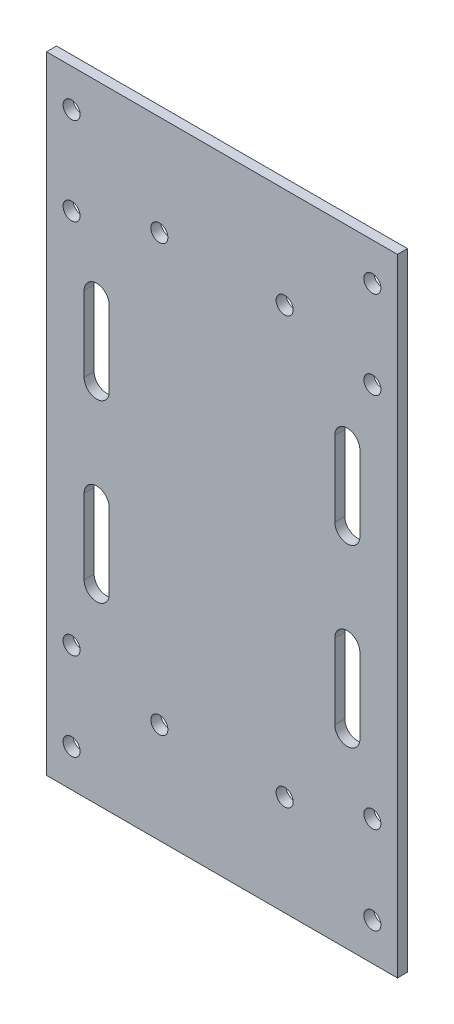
SolidWorks part; units mm, degrees
ref_plane "Front Plane" through (0, 0, 0) normal (0, 0, 1) x (1, 0, 0)
ref_plane "Top Plane" through (0, 0, 0) normal (0, 1, 0) x (1, 0, 0)
ref_plane "Right Plane" through (0, 0, 0) normal (1, 0, 0) x (0, 0, -1)
sketch "Sketch1" plane through (0, 0, 0) normal (0, 0, 1) x (1, 0, 0)
  line L1 (-35, -62.5) -> (35, -62.5)
  line L2 (-35, -62.5) -> (-35, 62.5)
  line L3 (-35, 62.5) -> (35, 62.5)
  line L4 (35, -62.5) -> (35, 62.5)
  line L5 (-35, -62.5) -> (35, 62.5) construction
  line L6 (-35, 62.5) -> (35, -62.5) construction
  point P0 (0, 0)
  dimension "D1" = 35
  dimension "D2" = 62.5
extrude "Boss-Extrude1" add sketch "Sketch1" against normal blind 2
sketch "Sketch2" plane through (0, 0, 0) normal (0, 0, 1) x (1, 0, 0)
  circle A0 centre (-30, -55) radius 1.7
  circle A1 centre (-30, -37.5) radius 1.7
  circle A2 centre (-30, 37.5) radius 1.7
  circle A3 centre (-30, 55) radius 1.7
  circle A4 centre (30, -55) radius 1.7
  circle A5 centre (30, -37.5) radius 1.7
  circle A6 centre (30, 37.5) radius 1.7
  circle A7 centre (30, 55) radius 1.7
  circle A8 centre (-12.5, -42.5) radius 1.7
  circle A9 centre (-12.5, 42.5) radius 1.7
  circle A10 centre (12.5, -42.5) radius 1.7
  circle A11 centre (12.5, 42.5) radius 1.7
  dimension "D1" = 3.4
  dimension "D2" = 12.5
  dimension "D3" = 30
  dimension "D4" = 12.5
  dimension "D5" = 30
  dimension "D6" = 37.5
  dimension "D7" = 42.5
  dimension "D8" = 55
  dimension "D9" = 37.5
  dimension "D10" = 42.5
  dimension "D11" = 55
extrude "Lo_xuyen_M3_D3_4" cut sketch "Sketch2" along normal through all and the other way through all
sketch "Sketch3" plane through (0, 0, 0) normal (0, 0, 1) x (1, 0, 0)
  line L1 (-27.5, -25) -> (-22.5, -25)
  line L2 (-27.5, -25) -> (-27.5, -10)
  line L3 (-27.5, -10) -> (-22.5, -10)
  line L4 (-22.5, -25) -> (-22.5, -10)
  line L5 (-27.5, -25) -> (-22.5, -10) construction
  line L6 (-27.5, -10) -> (-22.5, -25) construction
  line L7 (-27.5, 10) -> (-22.5, 10)
  line L8 (-27.5, 10) -> (-27.5, 25)
  line L9 (-27.5, 25) -> (-22.5, 25)
  line L10 (-22.5, 10) -> (-22.5, 25)
  line L11 (-27.5, 10) -> (-22.5, 25) construction
  line L12 (-27.5, 25) -> (-22.5, 10) construction
  line L13 (22.5, -25) -> (27.5, -25)
  line L14 (22.5, -25) -> (22.5, -10)
  line L15 (22.5, -10) -> (27.5, -10)
  line L16 (27.5, -25) -> (27.5, -10)
  line L17 (22.5, -25) -> (27.5, -10) construction
  line L18 (22.5, -10) -> (27.5, -25) construction
  line L19 (22.5, 10) -> (27.5, 10)
  line L20 (22.5, 10) -> (22.5, 25)
  line L21 (22.5, 25) -> (27.5, 25)
  line L22 (27.5, 10) -> (27.5, 25)
  line L23 (22.5, 10) -> (27.5, 25) construction
  line L24 (22.5, 25) -> (27.5, 10) construction
  point P0 (-25, -17.5)
  point P5 (-25, 17.5)
  point P10 (25, -17.5)
  point P15 (25, 17.5)
  dimension "D1" = 22.5
  dimension "D2" = 25
  dimension "D3" = 22.5
  dimension "D4" = 10
  dimension "D5" = 17.5
  dimension "D6" = 10
extrude "Than_ranh" cut sketch "Sketch3" along normal through all and the other way through all
sketch "Sketch4" plane through (0, 0, 0) normal (0, 0, 1) x (1, 0, 0)
  line L0 (-27.5, -25) -> (-22.5, -25) construction
  line L1 (-22.5, -10) -> (-27.5, -10) construction
  line L2 (-27.5, 10) -> (-22.5, 10) construction
  line L3 (-22.5, 25) -> (-27.5, 25) construction
  line L4 (22.5, -25) -> (27.5, -25) construction
  line L5 (27.5, -10) -> (22.5, -10) construction
  line L6 (22.5, 10) -> (27.5, 10) construction
  line L7 (27.5, 25) -> (22.5, 25) construction
  circle A0 centre (-25, -25) radius 2.5
  circle A1 centre (-25, -10) radius 2.5
  circle A2 centre (-25, 10) radius 2.5
  circle A3 centre (-25, 25) radius 2.5
  circle A4 centre (25, -25) radius 2.5
  circle A5 centre (25, -10) radius 2.5
  circle A6 centre (25, 10) radius 2.5
  circle A7 centre (25, 25) radius 2.5
extrude "Dau_ranh_R2_5" cut sketch "Sketch4" along normal through all and the other way through all
